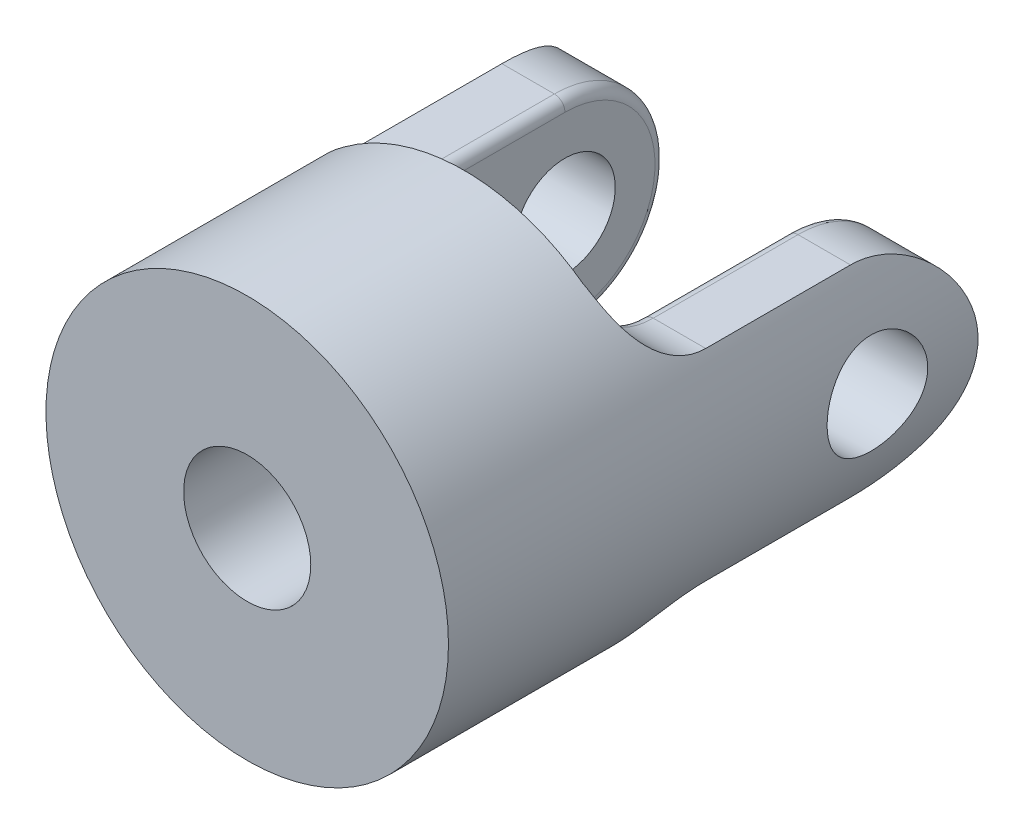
SolidWorks part; units mm, degrees
ref_plane "Ebene vorne" through (0, 0, 0) normal (0, 0, 1) x (1, 0, 0)
ref_plane "Ebene oben" through (0, 0, 0) normal (0, 1, 0) x (1, 0, 0)
ref_plane "Ebene rechts" through (0, 0, 0) normal (1, 0, 0) x (0, 0, -1)
sketch "Skizze1" plane through (0, 0, 0) normal (0, 0, 1) x (1, 0, 0)
  circle A0 centre (0, 0) radius 19
  dimension "D1" = 38
extrude "Linear austragen1" add sketch "Skizze1" along normal blind 50
sketch "Skizze4" plane through (0, 0, 0) normal (0, 1, 0) x (1, 0, 0)
  line L0 (0, -102.3606) -> (0, 17.9778) construction
  line L1 (19, 0) -> (-19, 0) construction
  line L2 (-10.5, 0) -> (10.5, 0)
  line L3 (-10.5, 0) -> (-10.5, -29.5)
  line L4 (-10.5, -29.5) -> (10.5, -29.5)
  line L5 (10.5, 0) -> (10.5, -29.5)
  dimension "D1" = 21
  dimension "D2" = 29.5
extrude "Linear austragen4" cut sketch "Skizze4" against normal mid plane 100
sketch "Skizze5" plane through (0, 0, 0) normal (1, 0, 0) x (0, 0, -1)
  line L0 (0, 0) -> (-28.5916, 0) construction
  circle A0 centre (-9.5, 0) radius 4.75
  dimension "D1" = 9.5
  dimension "D2" = 9.5
extrude "Linear austragen5" cut sketch "Skizze5" against normal mid plane 100
sketch "Skizze6" plane through (0, 0, 0) normal (1, 0, 0) x (0, 0, -1)
  line L0 (-29.5, 15.8351) -> (-29.5, 19) construction
  line L1 (0, 15.8351) -> (-29.5, 15.8351) construction
  line L2 (-23.1649, 9.5) -> (-9.5, 9.5)
  line L3 (-29.5, 15.8351) -> (-29.5, 19)
  line L4 (18.6327, 0) -> (-89.9628, 0) construction
  line L5 (-29.5, 19) -> (0, 19)
  line L6 (0, 19) -> (0, 0)
  arc A0 (-29.5, 15.8351) -> (-23.1649, 9.5) centre (-23.1649, 15.8351) ccw
  arc A1 (0, 0) -> (-9.5, 9.5) centre (-9.5, 0) ccw
extrude "Linear austragen6" cut sketch "Skizze6" against normal mid plane 100
mirror "Spiegeln1" about plane through (0, 0, 0) normal (0, 1, 0) of "Linear austragen6"
sketch "Skizze7" plane through (0, 0, 50) normal (0, 0, 1) x (1, 0, 0)
  circle A0 centre (0, 0) radius 6
  dimension "D1" = 12
extrude "Linear austragen7" cut sketch "Skizze7" against normal through all
fillet "Verrundung1" radius 1 10 edges at (-10.5, 11.3555, 27.6445) (-10.5, 9.5, 16.3325) (-10.5, 0, 0) (-10.5, -9.5, 16.3325) (10.5, 11.3555, 27.6445) (10.5, 9.5, 16.3325) (10.5, 0, 0) (10.5, -9.5, 16.3325) (-10.5, -11.3555, 27.6445) (10.5, -11.3555, 27.6445)
